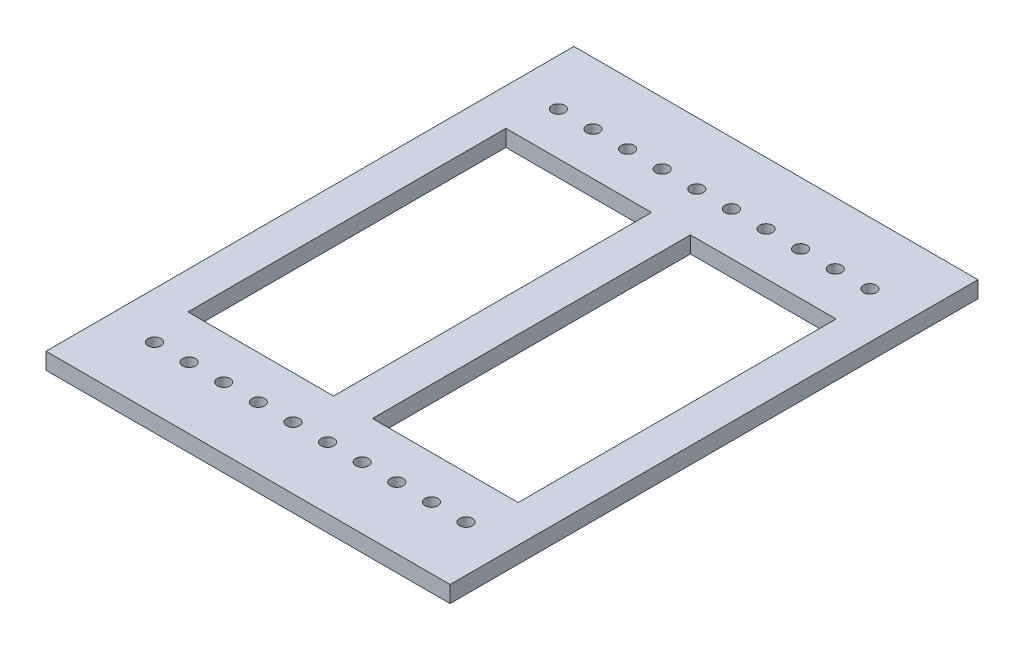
SolidWorks part; units mm, degrees
ref_plane "Front Plane" through (0, 0, 0) normal (0, 0, 1) x (1, 0, 0)
ref_plane "Top Plane" through (0, 0, 0) normal (0, 1, 0) x (1, 0, 0)
ref_plane "Right Plane" through (0, 0, 0) normal (1, 0, 0) x (0, 0, -1)
sketch "Sketch1" plane through (0, 0, 0) normal (0, 1, 0) x (1, 0, 0)
  line L0 (10.39, 27.15) -> (10.39, 0) construction
  line L1 (0, 0) -> (20.78, 0)
  line L2 (0, 0) -> (0, 27.15)
  line L3 (0, 27.15) -> (20.78, 27.15)
  line L4 (20.78, 0) -> (20.78, 27.15)
  line L5 (18.88, 5.4) -> (11.39, 5.4)
  line L6 (1.9, 21.75) -> (9.39, 21.75)
  line L7 (1.9, 21.75) -> (1.9, 5.4)
  line L8 (1.9, 5.4) -> (9.39, 5.4)
  line L9 (9.39, 21.75) -> (9.39, 5.4)
  line L10 (11.39, 21.75) -> (11.39, 5.4)
  line L11 (18.88, 21.75) -> (18.88, 5.4)
  line L12 (18.88, 21.75) -> (11.39, 21.75)
  line L13 (0, 23.96) -> (20.78, 23.96) construction
  line L14 (0, 13.575) -> (20.78, 13.575) construction
  circle A0 centre (2.389, 23.96) radius 0.33
  circle A1 centre (4.169, 23.96) radius 0.33
  circle A2 centre (5.949, 23.96) radius 0.33
  circle A3 centre (7.729, 23.96) radius 0.33
  circle A4 centre (9.509, 23.96) radius 0.33
  circle A5 centre (11.289, 23.96) radius 0.33
  circle A6 centre (13.069, 23.96) radius 0.33
  circle A7 centre (14.849, 23.96) radius 0.33
  circle A8 centre (16.629, 23.96) radius 0.33
  circle A9 centre (18.409, 23.96) radius 0.33
  circle A10 centre (18.409, 3.19) radius 0.33
  circle A11 centre (16.629, 3.19) radius 0.33
  circle A12 centre (14.849, 3.19) radius 0.33
  circle A13 centre (13.069, 3.19) radius 0.33
  circle A14 centre (11.289, 3.19) radius 0.33
  circle A15 centre (9.509, 3.19) radius 0.33
  circle A16 centre (7.729, 3.19) radius 0.33
  circle A17 centre (5.949, 3.19) radius 0.33
  circle A18 centre (4.169, 3.19) radius 0.33
  circle A19 centre (2.389, 3.19) radius 0.33
  point P19 (2.389, 23.96)
  dimension "D9" = 0.66
  dimension "D1" = 27.15
  dimension "D2" = 20.78
  dimension "D3" = 5.4
  dimension "D4" = 5.4
  dimension "D5" = 1
  dimension "D6" = 1.9
  dimension "D7" = 3.19
  dimension "D8" = 2.389
  dimension "D10" = 10
extrude "Boss-Extrude1" add sketch "Sketch1" along normal blind 0.85
